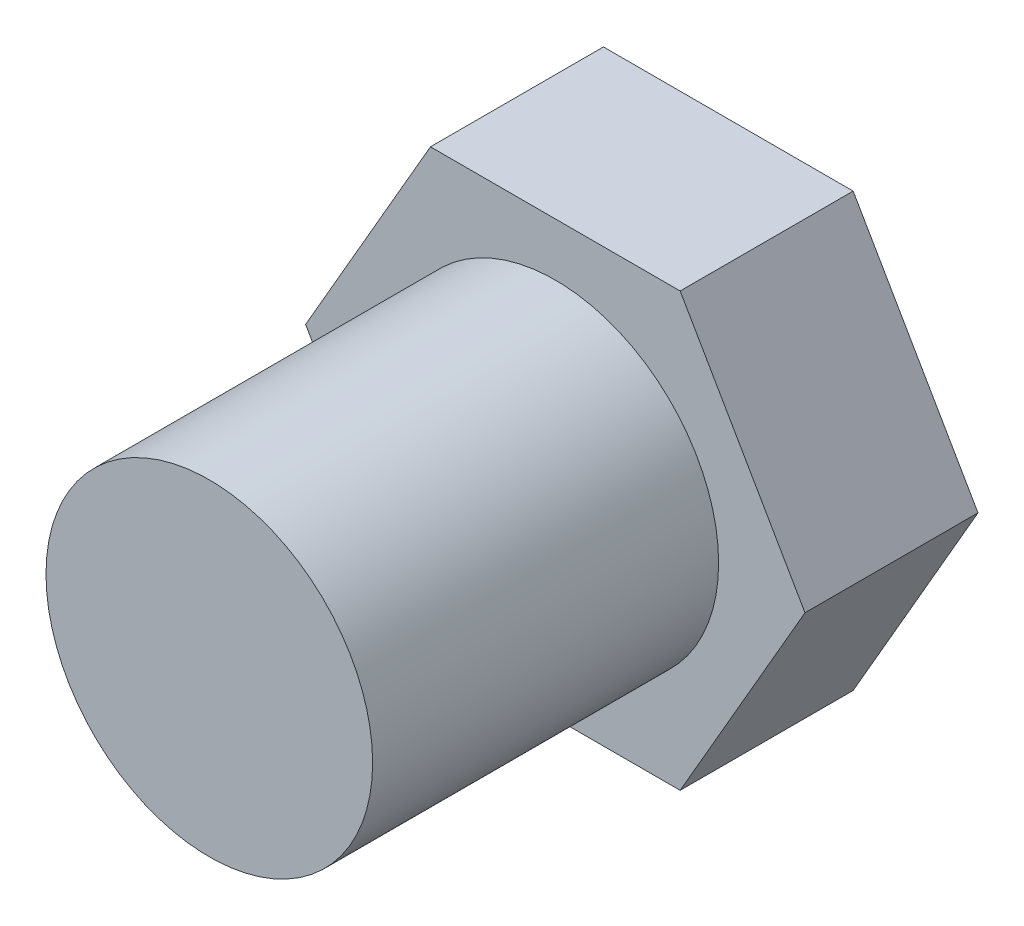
SolidWorks part; units mm, degrees
ref_plane "Front Plane" through (0, 0, 0) normal (0, 0, 1) x (1, 0, 0)
ref_plane "Top Plane" through (0, 0, 0) normal (0, 1, 0) x (1, 0, 0)
ref_plane "Right Plane" through (0, 0, 0) normal (1, 0, 0) x (0, 0, -1)
sketch "Sketch1" plane through (0, 0, 0) normal (0, 0, 1) x (1, 0, 0)
  circle A0 centre (0, 0) radius 5.9944
  dimension "D1" = 11.9888
extrude "Boss-Extrude1" add sketch "Sketch1" along normal blind 12.7
sketch "Sketch2" plane through (0, 0, 0) normal (0, 0, -1) x (-1, 0, 0)
  line L1 (9.1654, 0) -> (4.5827, 7.9375)
  line L2 (4.5827, 7.9375) -> (-4.5827, 7.9375)
  line L3 (-4.5827, 7.9375) -> (-9.1654, 0)
  line L4 (-9.1654, 0) -> (-4.5827, -7.9375)
  line L5 (-4.5827, -7.9375) -> (4.5827, -7.9375)
  line L6 (4.5827, -7.9375) -> (9.1654, 0)
  circle A0 centre (0, 0) radius 7.9375 construction
extrude "Boss-Extrude2" add sketch "Sketch2" along normal blind 6.35
